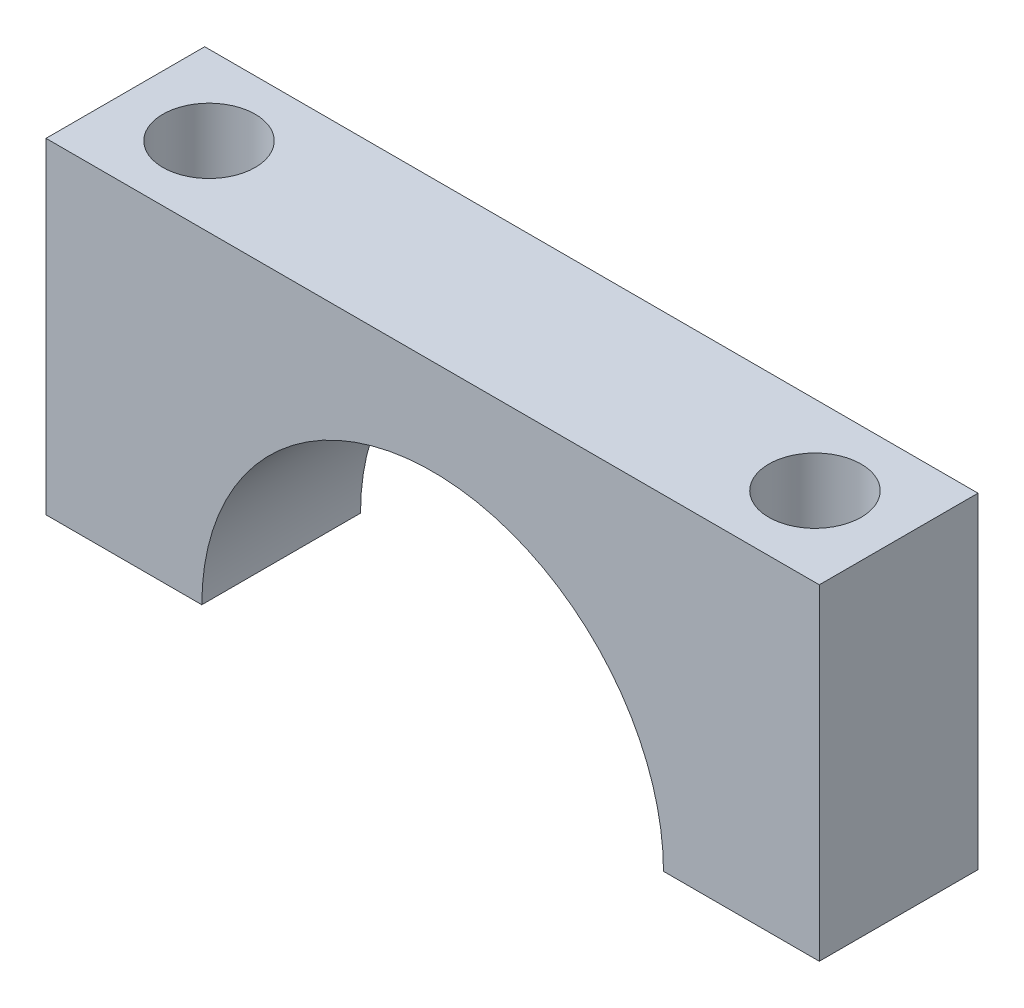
SolidWorks part; units mm, degrees
ref_plane "Front Plane" through (0, 0, 0) normal (0, 0, 1) x (1, 0, 0)
ref_plane "Top Plane" through (0, 0, 0) normal (0, 1, 0) x (1, 0, 0)
ref_plane "Right Plane" through (0, 0, 0) normal (1, 0, 0) x (0, 0, -1)
sketch "Sketch1" plane through (0, 0, 0) normal (0, 0, 1) x (1, 0, 0)
  line L0 (55, 0) -> (-55, 0) construction
  line L1 (-13.4, 11.3) -> (13.4, 11.3)
  line L2 (-13.4, 11.3) -> (-13.4, 0)
  line L3 (-13.4, 0) -> (-8, 0)
  line L4 (13.4, 11.3) -> (13.4, 0)
  line L5 (8, 0) -> (13.4, 0)
  line L6 (0, -55) -> (0, 55) construction
  arc A0 (8, 0) -> (-8, 0) centre (0, 0) ccw
  dimension "D2" = 8
  dimension "D1" = 11.3
  dimension "D3" = 26.8
extrude "Boss-Extrude1" add sketch "Sketch1" along normal mid plane 5.5
sketch "Sketch2" plane through (0, 0, 0) normal (0, -1, 0) x (1, 0, 0)
  line L0 (6.215, 0) -> (-6.215, 0) construction
  line L1 (-10.5, 0) -> (10.5, 0) construction
  circle A0 centre (-10.5, 0) radius 1.6
  circle A1 centre (10.5, 0) radius 1.6
  point P6 (0, 0)
  dimension "D1" = 3.2
  dimension "D2" = 21
extrude "Cut-Extrude1" cut sketch "Sketch2" against normal through all
